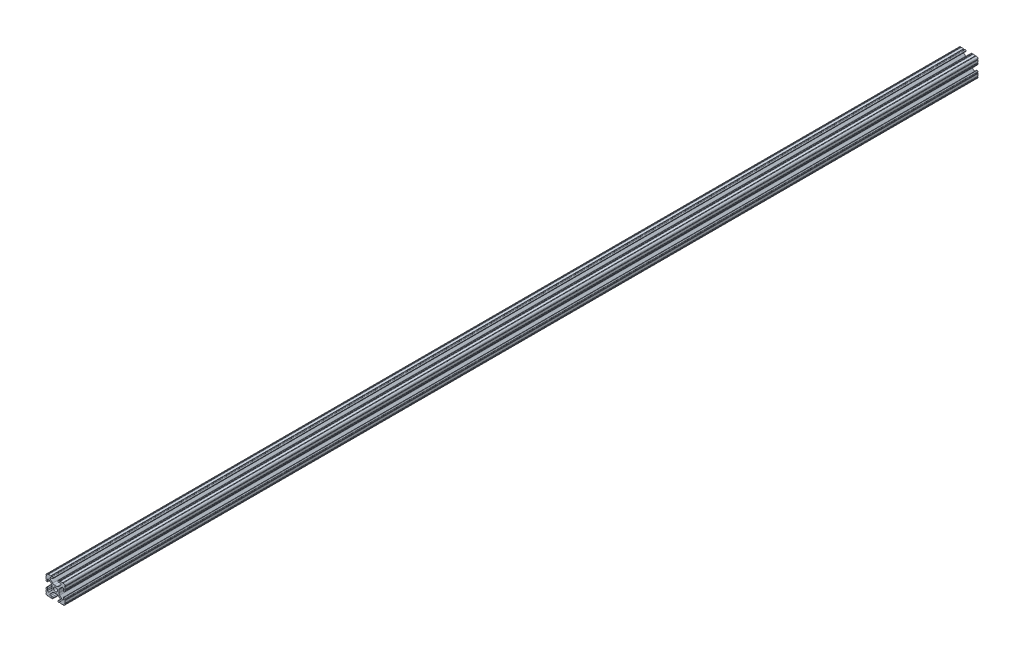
SolidWorks part; units mm, degrees
ref_plane "Front Plane" through (0, 0, 0) normal (0, 0, 1) x (1, 0, 0)
ref_plane "Top Plane" through (0, 0, 0) normal (0, 1, 0) x (1, 0, 0)
ref_plane "Right Plane" through (0, 0, 0) normal (1, 0, 0) x (0, 0, -1)
sketch "Sketch1" plane through (0, 0, 0) normal (0, 0, 1) x (1, 0, 0)
  line L88 (-7.1797, -8.6452) -> (-3.9523, -5.4237)
  line L89 (-1.7093, -4.4958) -> (1.7093, -4.4958)
  line L90 (3.9523, -5.4237) -> (7.1797, -8.6452)
  line L91 (6.4164, -10.4902) -> (4.2875, -10.4902)
  line L92 (3.2385, -11.5392) -> (3.2385, -11.651)
  line L93 (4.2875, -12.7) -> (5.3171, -12.7)
  line L94 (6.3331, -12.7) -> (9.5504, -12.7)
  line L95 (12.7, -9.5504) -> (12.7, -6.3331)
  line L96 (12.7, -5.3171) -> (12.7, -4.2875)
  line L97 (11.651, -3.2385) -> (11.5392, -3.2385)
  line L98 (10.4902, -4.2875) -> (10.4902, -6.4021)
  line L99 (8.7371, -7.1294) -> (5.441, -3.8408)
  line L100 (4.5085, -1.5932) -> (4.5085, 1.5932)
  line L101 (5.441, 3.8408) -> (8.7371, 7.1294)
  line L102 (10.4902, 6.4021) -> (10.4902, 4.2875)
  line L103 (11.5392, 3.2385) -> (11.651, 3.2385)
  line L104 (12.7, 4.2875) -> (12.7, 5.3171)
  line L105 (12.7, 6.3331) -> (12.7, 9.5504)
  line L106 (9.5504, 12.7) -> (6.3331, 12.7)
  line L107 (5.3171, 12.7) -> (4.2875, 12.7)
  line L108 (3.2385, 11.651) -> (3.2385, 11.5392)
  line L109 (4.2875, 10.4902) -> (6.4768, 10.4902)
  line L110 (7.207, 8.7244) -> (3.8983, 5.4232)
  line L111 (1.6558, 4.4958) -> (-1.6558, 4.4958)
  line L112 (-3.8983, 5.4232) -> (-7.207, 8.7244)
  line L113 (-6.4768, 10.4902) -> (-4.2875, 10.4902)
  line L114 (-3.2385, 11.5392) -> (-3.2385, 11.651)
  line L115 (-4.2875, 12.7) -> (-5.3171, 12.7)
  line L116 (-6.3331, 12.7) -> (-9.5504, 12.7)
  line L117 (-12.7, 9.5504) -> (-12.7, 6.3331)
  line L118 (-12.7, 5.3171) -> (-12.7, 4.2875)
  line L119 (-11.651, 3.2385) -> (-11.5392, 3.2385)
  line L120 (-10.4902, 4.2875) -> (-10.4902, 6.4021)
  line L121 (-8.7371, 7.1294) -> (-5.441, 3.8408)
  line L122 (-4.5085, 1.5932) -> (-4.5085, -1.5932)
  line L123 (-5.441, -3.8408) -> (-8.7371, -7.1294)
  line L124 (-10.4902, -6.4021) -> (-10.4902, -4.2875)
  line L125 (-11.5392, -3.2385) -> (-11.651, -3.2385)
  line L126 (-12.7, -4.2875) -> (-12.7, -5.3171)
  line L127 (-12.7, -6.3331) -> (-12.7, -9.5504)
  line L128 (-9.5504, -12.7) -> (-6.3331, -12.7)
  line L129 (-5.3171, -12.7) -> (-4.2875, -12.7)
  line L130 (-3.2385, -11.651) -> (-3.2385, -11.5392)
  line L131 (-4.2875, -10.4902) -> (-6.4164, -10.4902)
  circle A1 centre (0, 0) radius 2.6035
  arc A104 (-7.1797, -8.6452) -> (-6.4164, -10.4902) centre (-6.4164, -9.4098) ccw
  arc A105 (-1.7093, -4.4958) -> (-3.9523, -5.4237) centre (-1.7093, -7.6708) ccw
  arc A106 (3.9523, -5.4237) -> (1.7093, -4.4958) centre (1.7093, -7.6708) ccw
  arc A107 (6.4164, -10.4902) -> (7.1797, -8.6452) centre (6.4164, -9.4098) ccw
  arc A108 (4.2875, -10.4902) -> (3.2385, -11.5392) centre (4.2875, -11.5392) ccw
  arc A109 (3.2385, -11.651) -> (4.2875, -12.7) centre (4.2875, -11.651) ccw
  arc A110 (6.3331, -12.7) -> (5.3171, -12.7) centre (5.8251, -12.7) ccw
  arc A111 (10.5664, -12.6998) -> (9.5504, -12.7) centre (10.0584, -12.7) ccw
  arc A112 (10.5664, -12.6998) -> (12.6998, -10.5664) centre (10.5918, -10.5918) ccw
  arc A113 (12.7, -9.5504) -> (12.6998, -10.5664) centre (12.7, -10.0584) ccw
  arc A114 (12.7, -5.3171) -> (12.7, -6.3331) centre (12.7, -5.8251) ccw
  arc A115 (12.7, -4.2875) -> (11.651, -3.2385) centre (11.651, -4.2875) ccw
  arc A116 (11.5392, -3.2385) -> (10.4902, -4.2875) centre (11.5392, -4.2875) ccw
  arc A117 (8.7371, -7.1294) -> (10.4902, -6.4021) centre (9.4628, -6.4021) ccw
  arc A118 (4.5085, -1.5932) -> (5.441, -3.8408) centre (7.6835, -1.5932) ccw
  arc A119 (5.441, 3.8408) -> (4.5085, 1.5932) centre (7.6835, 1.5932) ccw
  arc A120 (10.4902, 6.4021) -> (8.7371, 7.1294) centre (9.4628, 6.4021) ccw
  arc A121 (10.4902, 4.2875) -> (11.5392, 3.2385) centre (11.5392, 4.2875) ccw
  arc A122 (11.651, 3.2385) -> (12.7, 4.2875) centre (11.651, 4.2875) ccw
  arc A123 (12.7, 6.3331) -> (12.7, 5.3171) centre (12.7, 5.8251) ccw
  arc A124 (12.6998, 10.5664) -> (12.7, 9.5504) centre (12.7, 10.0584) ccw
  arc A125 (12.6998, 10.5664) -> (10.5664, 12.6998) centre (10.5918, 10.5918) ccw
  arc A126 (9.5504, 12.7) -> (10.5664, 12.6998) centre (10.0584, 12.7) ccw
  arc A127 (5.3171, 12.7) -> (6.3331, 12.7) centre (5.8251, 12.7) ccw
  arc A128 (4.2875, 12.7) -> (3.2385, 11.651) centre (4.2875, 11.651) ccw
  arc A129 (3.2385, 11.5392) -> (4.2875, 10.4902) centre (4.2875, 11.5392) ccw
  arc A130 (7.207, 8.7244) -> (6.4768, 10.4902) centre (6.4768, 9.4563) ccw
  arc A131 (1.6558, 4.4958) -> (3.8983, 5.4232) centre (1.6558, 7.6708) ccw
  arc A132 (-3.8983, 5.4232) -> (-1.6558, 4.4958) centre (-1.6558, 7.6708) ccw
  arc A133 (-6.4768, 10.4902) -> (-7.207, 8.7244) centre (-6.4768, 9.4563) ccw
  arc A134 (-4.2875, 10.4902) -> (-3.2385, 11.5392) centre (-4.2875, 11.5392) ccw
  arc A135 (-3.2385, 11.651) -> (-4.2875, 12.7) centre (-4.2875, 11.651) ccw
  arc A136 (-6.3331, 12.7) -> (-5.3171, 12.7) centre (-5.8251, 12.7) ccw
  arc A137 (-10.5664, 12.6998) -> (-9.5504, 12.7) centre (-10.0584, 12.7) ccw
  arc A138 (-10.5664, 12.6998) -> (-12.6998, 10.5664) centre (-10.5918, 10.5918) ccw
  arc A139 (-12.7, 9.5504) -> (-12.6998, 10.5664) centre (-12.7, 10.0584) ccw
  arc A140 (-12.7, 5.3171) -> (-12.7, 6.3331) centre (-12.7, 5.8251) ccw
  arc A141 (-12.7, 4.2875) -> (-11.651, 3.2385) centre (-11.651, 4.2875) ccw
  arc A142 (-11.5392, 3.2385) -> (-10.4902, 4.2875) centre (-11.5392, 4.2875) ccw
  arc A143 (-8.7371, 7.1294) -> (-10.4902, 6.4021) centre (-9.4628, 6.4021) ccw
  arc A144 (-4.5085, 1.5932) -> (-5.441, 3.8408) centre (-7.6835, 1.5932) ccw
  arc A145 (-5.441, -3.8408) -> (-4.5085, -1.5932) centre (-7.6835, -1.5932) ccw
  arc A146 (-10.4902, -6.4021) -> (-8.7371, -7.1294) centre (-9.4628, -6.4021) ccw
  arc A147 (-10.4902, -4.2875) -> (-11.5392, -3.2385) centre (-11.5392, -4.2875) ccw
  arc A148 (-11.651, -3.2385) -> (-12.7, -4.2875) centre (-11.651, -4.2875) ccw
  arc A149 (-12.7, -6.3331) -> (-12.7, -5.3171) centre (-12.7, -5.8251) ccw
  arc A150 (-12.6998, -10.5664) -> (-12.7, -9.5504) centre (-12.7, -10.0584) ccw
  arc A151 (-12.6998, -10.5664) -> (-10.5664, -12.6998) centre (-10.5918, -10.5918) ccw
  arc A152 (-9.5504, -12.7) -> (-10.5664, -12.6998) centre (-10.0584, -12.7) ccw
  arc A153 (-5.3171, -12.7) -> (-6.3331, -12.7) centre (-5.8251, -12.7) ccw
  arc A154 (-4.2875, -12.7) -> (-3.2385, -11.651) centre (-4.2875, -11.651) ccw
  arc A155 (-3.2385, -11.5392) -> (-4.2875, -10.4902) centre (-4.2875, -11.5392) ccw
extrude "Boss-Extrude1" add sketch "Sketch1" along normal mid plane 1524
sketch "Sketch2" plane through (0, 0, 0) normal (1, 0, 0) x (0, 0, -1)
  line L0 (762, -9.5504) -> (762, -6.3331) construction
  line L1 (762, 40.4618) -> (457.2, 40.4618)
  line L2 (762, 40.4618) -> (762, -35.2458)
  line L3 (762, -35.2458) -> (457.2, -35.2458)
  line L4 (457.2, 40.4618) -> (457.2, -35.2458)
  dimension "D1" = 304.8
extrude "Cut-Extrude1" cut sketch "Sketch2" against normal through all both and the other way through all
